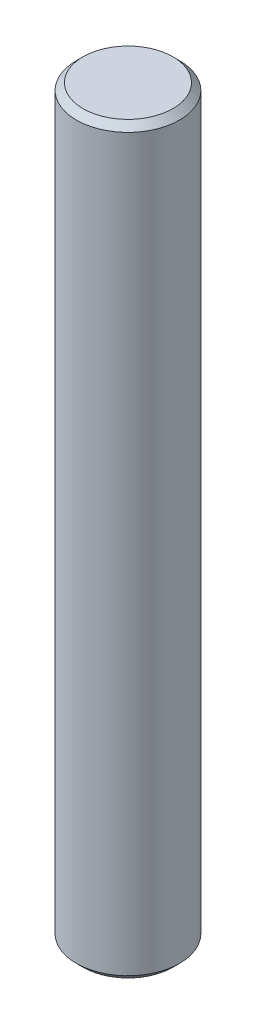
SolidWorks part; units mm, degrees
ref_plane "Front/Back" through (0, 0, 0) normal (0, 0, 1) x (1, 0, 0)
ref_plane "Top/Bottom" through (0, 0, 0) normal (0, 1, 0) x (1, 0, 0)
ref_plane "Right/Left" through (0, 0, 0) normal (1, 0, 0) x (0, 0, -1)
sketch "Sketch1" plane through (0, 0, 0) normal (0, 1, 0) x (1, 0, 0)
  circle A0 centre (0, 0) radius 1.9812
  dimension "D1" = 3.9624
extrude "Extrude1" add sketch "Sketch1" along normal mid plane 28.575
chamfer "Chamfer1" distance 0.254 angle 45
